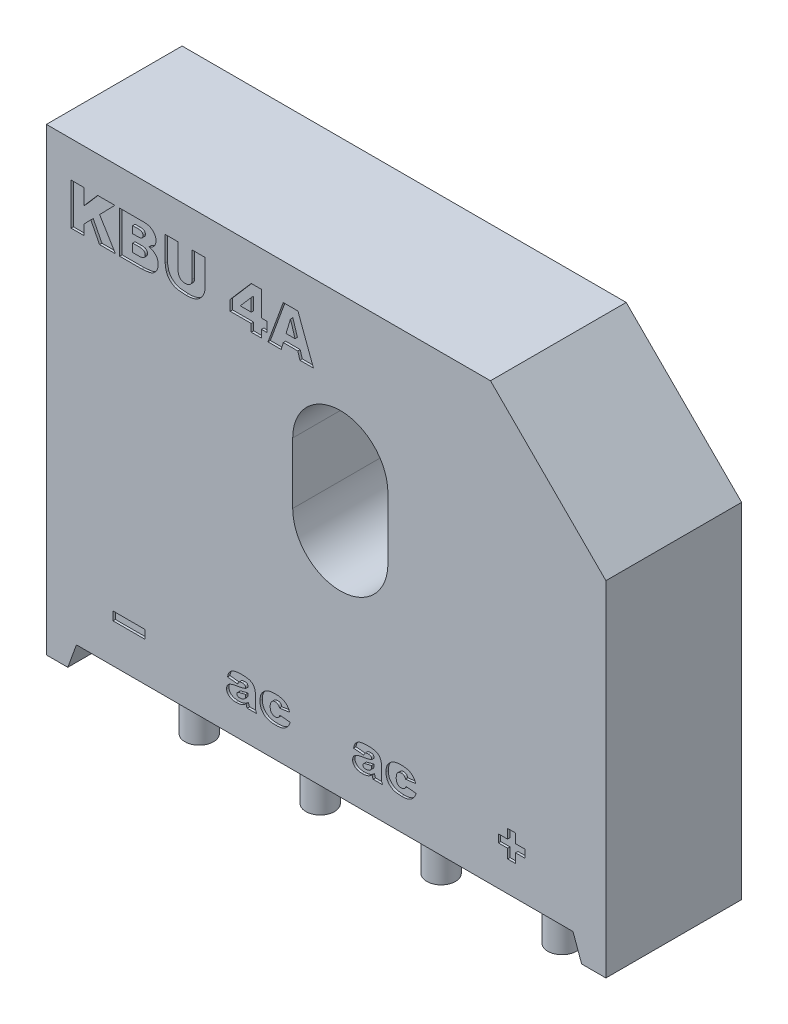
SolidWorks part; units mm, degrees
ref_plane "Front Plane" through (0, 0, 0) normal (0, 0, 1) x (1, 0, 0)
ref_plane "Top Plane" through (0, 0, 0) normal (0, 1, 0) x (1, 0, 0)
ref_plane "Right Plane" through (0, 0, 0) normal (1, 0, 0) x (0, 0, -1)
sketch "Sketch1" plane through (0, 0, 0) normal (0, 0, 1) x (1, 0, 0)
  line L0 (0, 0) -> (0, 19.3)
  line L1 (0, 19.3) -> (18.6524, 19.3)
  line L2 (0, 0) -> (0.8999, 0)
  line L3 (0.8999, 0) -> (1.2615, 1)
  line L4 (1.2615, 1) -> (22.1184, 1)
  line L5 (22.1184, 1) -> (22.4799, 0)
  line L6 (22.4799, 0) -> (23.5, 0)
  line L7 (23.5, 0) -> (23.5, 14.4524)
  line L8 (23.5, 14.4524) -> (18.6524, 19.3)
  line L9 (12.3453, 10.5) -> (12.3453, 13.065) construction
  line L10 (10.3453, 10.5) -> (10.3453, 13.065)
  line L11 (14.3453, 10.5) -> (14.3453, 13.065)
  arc A0 (10.3453, 10.5) -> (14.3453, 10.5) centre (12.3453, 10.5) ccw
  arc A1 (14.3453, 13.065) -> (10.3453, 13.065) centre (12.3453, 13.065) ccw
  point P12 (12.3453, 11.7825)
  dimension "D5" = 10.5
  dimension "D1" = 1
  dimension "D2" = 19.3
  dimension "D3" = 23.5
  dimension "D4" = 45
extrude "Bridge Body Extrude" add sketch "Sketch1" along normal blind 5.7
sketch "Sketch2" plane through (0, 0, 5.7) normal (0, 0, 1) x (1, 0, 0)
  text T0 "-"
  text T1 "+" font "Arial Black" height 1.5
  text T2 "ac" font "Arial Black" height 1.5
  text T3 "ac" font "Arial Black" height 1.5
  text T4 "KBU 4A" font "Arial Black" height 1.75
extrude "Pin Text Cut" cut sketch "Sketch2" against normal blind 0.1
sketch "Sketch3" plane through (0, 1, 0) normal (0, -1, 0) x (1, 0, 0)
  line L0 (11.6899, 5.7) -> (11.6899, 0) construction
  line L1 (1.2615, 5.7) -> (22.1184, 5.7) construction
  line L2 (1.2615, 0) -> (22.1184, 0) construction
  line L3 (0, 3.35) -> (23.5, 3.35) construction
  line L4 (0, 5.7) -> (0, 0) construction
  line L5 (23.5, 5.7) -> (23.5, 0) construction
  circle A0 centre (9.1499, 3.35) radius 0.6
  circle A1 centre (4.0699, 3.35) radius 0.6
  circle A2 centre (14.2299, 3.35) radius 0.6
  circle A3 centre (19.3099, 3.35) radius 0.6
  dimension "D2" = 1.2
  dimension "D4" = 5.08
  dimension "D1" = 3.35
  dimension "D3" = 2.54
extrude "PCB Pin Extrude" add sketch "Sketch3" along normal blind 3
